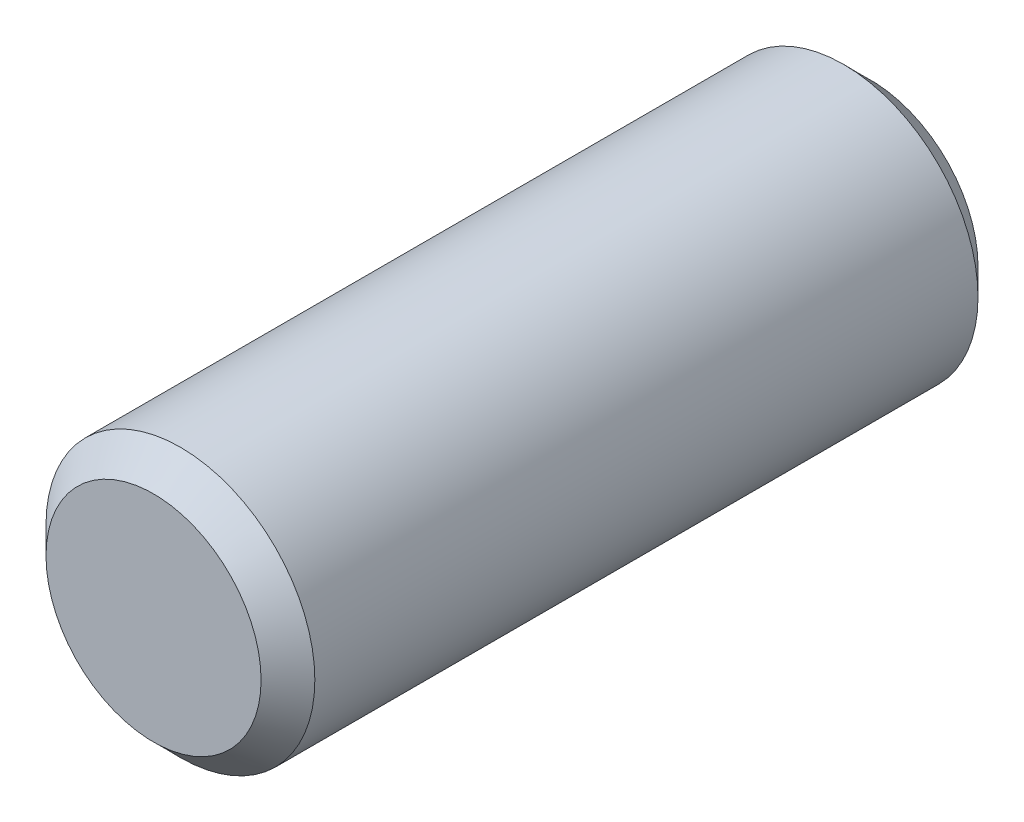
SolidWorks part; units mm, degrees
ref_plane "Plan de face" through (0, 0, 0) normal (0, 0, 1) x (1, 0, 0)
ref_plane "Plan de dessus" through (0, 0, 0) normal (0, 1, 0) x (1, 0, 0)
ref_plane "Plan de droite" through (0, 0, 0) normal (1, 0, 0) x (0, 0, -1)
sketch "Esquisse1" plane through (0, 0, 0) normal (0, 0, 1) x (1, 0, 0)
  circle A0 centre (0, 0) radius 1.5
  dimension "D1" = 3
extrude "Boss.-Extru.1" add sketch "Esquisse1" along normal blind 8
chamfer "Chanfrein1" distance 0.3 angle 45 2 edges at (1.5, 0, 0) (1.5, 0, 8)
sketch "Esquisse2" plane through (0, 0, 0) normal (0, 0, -1) x (-1, 0, 0)
  line L1 (1.1547, 0) -> (0.5774, 1)
  line L2 (0.5774, 1) -> (-0.5774, 1)
  line L3 (-0.5774, 1) -> (-1.1547, 0)
  line L4 (-1.1547, 0) -> (-0.5774, -1)
  line L5 (-0.5774, -1) -> (0.5774, -1)
  line L6 (0.5774, -1) -> (1.1547, 0)
  circle A0 centre (0, 0) radius 1 construction
  dimension "D1" = 2
extrude "Enlèv. mat.-Extru.1" cut sketch "Esquisse2" against normal blind 2
